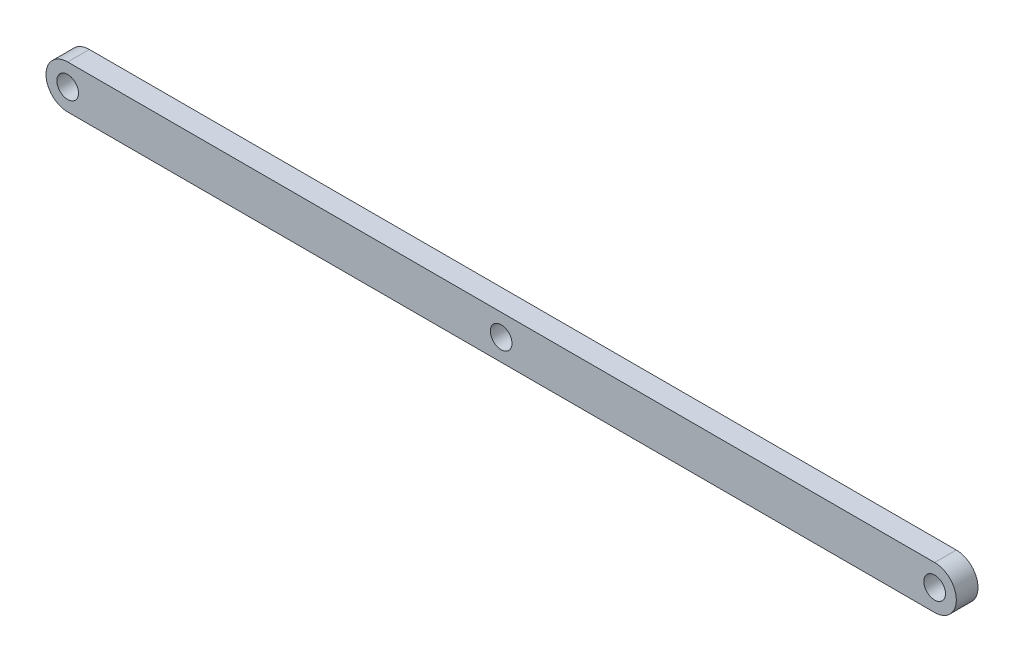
SolidWorks part; units mm, degrees
ref_plane "Front Plane" through (0, 0, 0) normal (0, 0, 1) x (1, 0, 0)
ref_plane "Top Plane" through (0, 0, 0) normal (0, 1, 0) x (1, 0, 0)
ref_plane "Right Plane" through (0, 0, 0) normal (1, 0, 0) x (0, 0, -1)
sketch "Sketch1" plane through (0, 0, 0) normal (0, 0, 1) x (1, 0, 0)
  line L0 (0, 0) -> (127, 0) construction
  line L1 (0, 3.175) -> (127, 3.175)
  line L2 (0, -3.175) -> (127, -3.175)
  arc A0 (0, 3.175) -> (0, -3.175) centre (0, 0) ccw
  arc A1 (127, -3.175) -> (127, 3.175) centre (127, 0) ccw
  circle A2 centre (0, 0) radius 1.5875
  circle A3 centre (127, 0) radius 1.5875
  circle A4 centre (63.5, 0) radius 1.5875
  point P3 (63.5, 0)
  dimension "D1" = 3.175
  dimension "D2" = 3.175
  dimension "D3" = 127
extrude "Boss-Extrude1" add sketch "Sketch1" along normal blind 3.175
